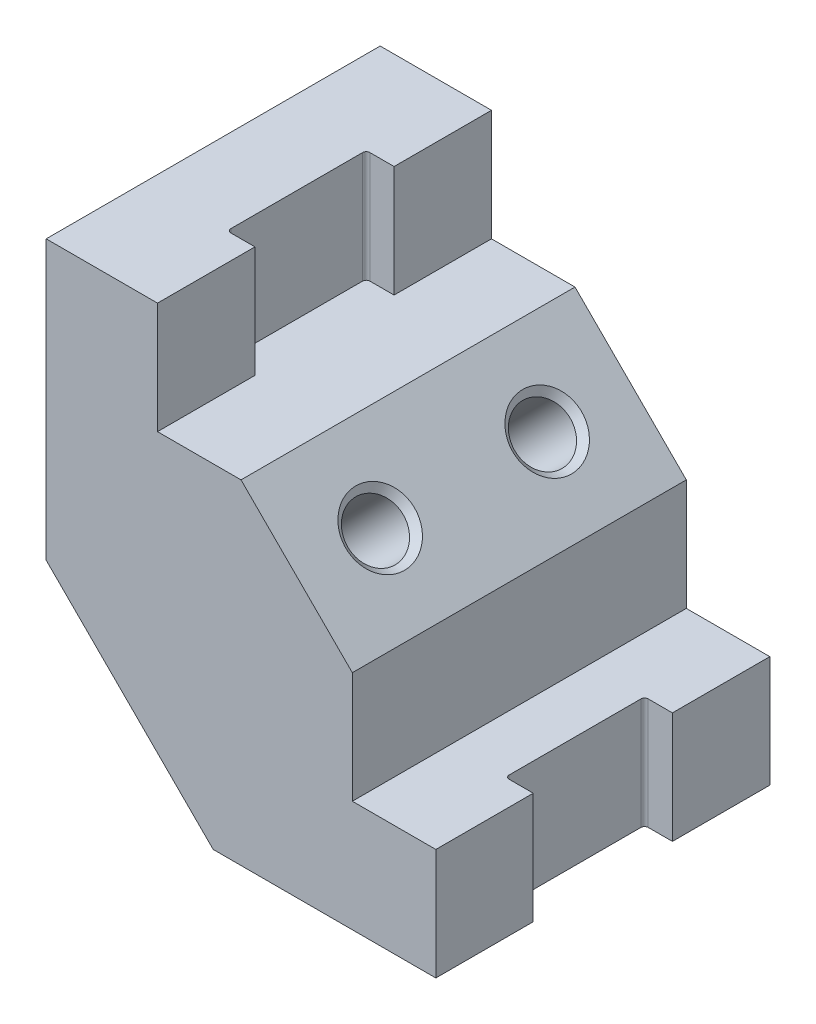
SolidWorks part; units mm, degrees
ref_plane "Front Plane" through (0, 0, 0) normal (0, 0, 1) x (1, 0, 0)
ref_plane "Top Plane" through (0, 0, 0) normal (0, 1, 0) x (1, 0, 0)
ref_plane "Right Plane" through (0, 0, 0) normal (1, 0, 0) x (0, 0, -1)
sketch "Sketch1" plane through (0, 0, 0) normal (0, 0, 1) x (1, 0, 0)
  line L0 (0, 0) -> (25.4, 0)
  line L1 (25.4, 0) -> (25.4, -25.4)
  line L2 (25.4, -25.4) -> (44.45, -25.4)
  line L3 (44.45, -25.4) -> (69.85, -50.8)
  line L4 (69.85, -50.8) -> (69.85, -76.2)
  line L5 (69.85, -76.2) -> (88.9, -76.2)
  line L6 (88.9, -76.2) -> (88.9, -101.6)
  line L7 (88.9, -101.6) -> (38.1, -101.6)
  line L8 (38.1, -101.6) -> (0, -63.5)
  line L9 (0, -63.5) -> (0, 0)
  dimension "D1" = 38.1
  dimension "D2" = 88.9
  dimension "D3" = 25.4
  dimension "D4" = 44.45
  dimension "D5" = 25.4
  dimension "D6" = 50.8
  dimension "D7" = 76.2
  dimension "D8" = 45
  dimension "D9" = 101.6
extrude "Boss-Extrude1" add sketch "Sketch1" along normal mid plane 76.2
sketch "Sketch2" plane through (9.525, 9.525, 0) normal (0.7071, 0.7071, 0) x (0, 0, -1)
  line L0 (0, 0) -> (0, -134.7038) construction
  line L1 (-38.1, -134.7038) -> (38.1, -134.7038) construction
  line L2 (-38.1, -85.3124) -> (38.1, -85.3124) construction
  circle A0 centre (-19.05, -67.3546) radius 6.35
  circle A1 centre (19.05, -67.3546) radius 6.35
  dimension "D1" = 12.7
  dimension "D2" = 38.1
  dimension "D3" = 17.9578
extrude "Cut-Extrude1" cut sketch "Sketch2" against normal through all
sketch "Sketch3" plane through (0, 0, 0) normal (0, 1, 0) x (1, 0, 0)
  line L0 (25.4, -38.1) -> (25.4, 38.1) construction
  line L1 (25.4, -15.875) -> (19.05, -15.875)
  line L2 (25.4, -15.875) -> (25.4, 15.875)
  line L3 (25.4, 15.875) -> (19.05, 15.875)
  line L4 (19.05, -15.875) -> (19.05, 15.875)
  line L5 (25.4, 0) -> (0, 0) construction
  dimension "D1" = 6.35
  dimension "D2" = 31.75
extrude "Cut-Extrude2" cut sketch "Sketch3" against normal up to vertex (25.4 mm away)
sketch "Sketch4" plane through (0, -76.2, 0) normal (0, 1, 0) x (1, 0, 0)
  line L1 (88.9, -15.875) -> (82.55, -15.875)
  line L2 (88.9, -15.875) -> (88.9, 15.875)
  line L3 (88.9, 15.875) -> (82.55, 15.875)
  line L4 (82.55, -15.875) -> (82.55, 15.875)
  line L5 (88.9, 0) -> (68.5513, 0) construction
  line L6 (88.9, -38.1) -> (88.9, 38.1) construction
  dimension "D1" = 6.35
  dimension "D2" = 31.75
extrude "Cut-Extrude3" cut sketch "Sketch4" against normal up to vertex (25.4 mm away)
fillet "Fillet1" radius 0.8382 4 edges at (82.55, -88.9, -15.875) (82.55, -88.9, 15.875) (19.05, -12.7, -15.875) (19.05, -12.7, 15.875)
chamfer "Chamfer1" distance 1.524 angle 45 4 edges at (11.3868, -74.8868, -19.05) (61.642, -42.592, -19.05) (11.3868, -74.8868, 19.05) (52.6618, -33.6118, 19.05)
